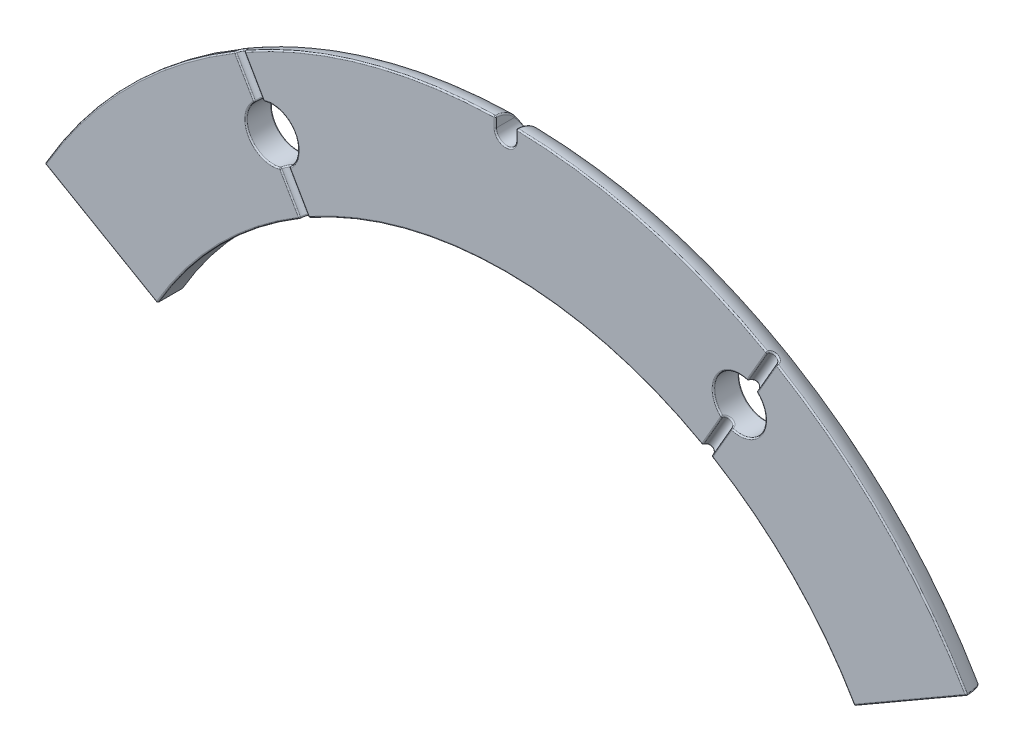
SolidWorks part; units mm, degrees
ref_plane "Спереди" through (0, 0, 0) normal (0, 0, 1) x (1, 0, 0)
ref_plane "Сверху" through (0, 0, 0) normal (0, 1, 0) x (1, 0, 0)
ref_plane "Справа" through (0, 0, 0) normal (1, 0, 0) x (0, 0, -1)
sketch "Эскиз1" plane through (0, 0, 0) normal (0, 0, 1) x (1, 0, 0)
  line L0 (0, 0) -> (177.5352, 102.5) construction
  line L1 (0, 0) -> (-177.5352, 102.5) construction
  line L2 (0, 0) -> (0, 205) construction
  line L3 (-177.5352, 102.5) -> (-134.2339, 77.5)
  line L4 (177.5352, 102.5) -> (134.2339, 77.5)
  line L5 (0, 0) -> (102.5, 177.5352) construction
  line L6 (0, 0) -> (-102.5, 177.5352) construction
  arc A0 (177.5352, 102.5) -> (-177.5352, 102.5) centre (0, 0) ccw
  arc A1 (134.2339, 77.5) -> (-134.2339, 77.5) centre (0, 0) ccw
  arc A2 (155.8846, 90) -> (-155.8846, 90) centre (0, 0) ccw construction
  circle A3 centre (-90, 155.8846) radius 10
  circle A4 centre (90, 155.8846) radius 10
  circle A5 centre (0, 0) radius 205 construction
  circle A6 centre (0, 0) radius 180 construction
  circle A7 centre (0, 0) radius 155 construction
  dimension "D1" = 410
  dimension "D8" = 20
  dimension "D4" = 60
  dimension "D5" = 120
  dimension "D6" = 60
  dimension "D7" = 30
  dimension "D2" = 50
  dimension "D3" = 25
extrude "Бобышка-Вытянуть1" add sketch "Эскиз1" against normal blind 10
fillet "Скругление1" radius 10 1 edges at (0, 205, -10)
fillet "Скругление2" radius 0.5 15 edges at (-155.8846, 90, 0) (-151.5544, 87.5, -10) (151.5544, 87.5, -10) (155.8846, 90, 0) (-134.2339, 77.5, -5) (0, 155, -10) (134.2339, 77.5, -5) (0, 155, 0) (100, 155.8846, 0) (100, 155.8846, -10) (-80, 155.8846, 0) (-80, 155.8846, -10) (-174.9987, 101.0355, -7.0711) (174.9987, 101.0355, -7.0711) (0, 205, 0)
ref_plane "Плоскость1" through (0, 0, 0) normal (-0.5, 0.866, 0) x (-0.866, -0.5, 0)
sketch "Эскиз2" plane through (0, 0, 0) normal (-0.5, 0.866, 0) x (-0.866, -0.5, 0)
  circle A0 centre (0, 0) radius 2
  dimension "D1" = 4
extrude "Вырез-Вытянуть1" cut sketch "Эскиз2" along normal through all
ref_plane "Плоскость2" through (0, 0, 0) normal (0.5, 0.866, 0) x (-0.866, 0.5, 0)
sketch "Эскиз3" plane through (0, 0, 0) normal (0.5, 0.866, 0) x (-0.866, 0.5, 0)
  circle A0 centre (0, 0) radius 2
  dimension "D1" = 4
extrude "Вырез-Вытянуть2" cut sketch "Эскиз3" along normal through all
fillet "Скругление3" radius 0.5 32 edges at (83.3082, 148.2804, -0.1644) (86.7751, 146.3211, -0.2102) (93.2249, 165.4481, -0.2102) (96.6918, 163.4887, -0.1644) (84.9454, 147.2561, -1.999) (95.0546, 164.5131, -1.999) (102.5857, 177.255, -1.9885) (104.1652, 176.4418, -0.2117) (100.4283, 169.9468, 0) (96.9642, 171.9468, 0) (100.6734, 178.364, -0.122) (83.0269, 139.8068, 0) (79.2967, 133.356, -0.1421) (77.4457, 134.2653, -1.999) (75.8223, 135.3094, -0.1931) (79.5628, 141.8068, 0) (-86.7605, 146.2872, -0.1644) (-83.3302, 148.31, -0.2102) (-96.6698, 163.4591, -0.2102) (-93.2395, 165.4819, -0.1644) (-85.0548, 147.1929, -1.999) (-94.9452, 164.5762, -1.999) (-102.2145, 177.4693, -1.9885) (-100.7205, 178.4306, -0.2117) (-96.9642, 171.9468, 0) (-100.4283, 169.9468, 0) (-104.131, 176.3677, -0.122) (-79.5628, 141.8068, 0) (-75.8413, 135.351, -0.1421) (-77.5543, 134.2026, -1.999) (-79.2702, 133.3187, -0.1931) (-83.0269, 139.8068, 0)
sketch "Эскиз4" plane through (0, 0, 0) normal (0, 0, 1) x (1, 0, 0)
  line L3 (-4, 205) -> (-4, 201)
  line L4 (4, 205) -> (-4, 205)
  line L5 (4, 201) -> (4, 205)
  line L6 (-4, 205) -> (-4, 201)
  line L7 (4, 205) -> (-4, 205)
  line L8 (4, 201) -> (4, 205)
  arc A1 (-4, 201) -> (4, 201) centre (0, 201) ccw
  arc A2 (-4, 201) -> (4, 201) centre (0, 201) ccw
  dimension "D1" = 0
extrude "Вырез-Вытянуть3" cut sketch "Эскиз4" against normal blind 10
fillet "Скругление4" radius 0.5 8 edges at (-0.4141, 197.0215, -9.7935) (4, 185.6913, 3.7615) (4, 204.7306, -0.0877) (4, 202.7239, 0) (0, 197, 0) (-4, 202.7239, 0) (-4, 204.8106, -0.156) (-4, 186.6815, 5.6137)
